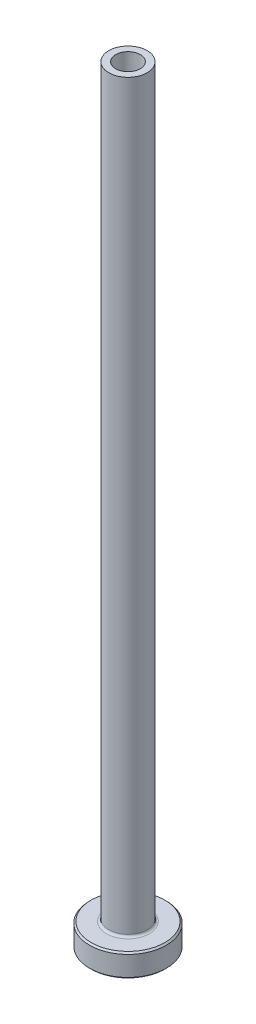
SolidWorks part; units mm, degrees
ref_plane "Front Plane" through (0, 0, 0) normal (0, 0, 1) x (1, 0, 0)
ref_plane "Top Plane" through (0, 0, 0) normal (0, 1, 0) x (1, 0, 0)
ref_plane "Right Plane" through (0, 0, 0) normal (1, 0, 0) x (0, 0, -1)
sketch "Sketch1" plane through (0, 0, 0) normal (0, 0, 1) x (1, 0, 0)
  line L0 (-1.6, 100) -> (-2.5, 100)
  line L1 (-2.5, 100) -> (-2.5, 3)
  line L2 (-2.5, 3) -> (-5, 3)
  line L3 (-5, 3) -> (-5, 0)
  line L4 (4.4, 0) -> (-4.4, 0) construction
  line L5 (-5, 0) -> (-1.85, 0)
  line L6 (-1.6, 55) -> (-1.6, 100)
  line L7 (0, 92.1877) -> (0, -15.5353) construction
  line L8 (0, -4.4) -> (0, 4.4) construction
  line L9 (-1.6, 55) -> (-1.85, 43)
  line L10 (-1.85, 43) -> (-1.85, 0)
  dimension "D1" = 0.25
  dimension "ID" = 3.2
  dimension "OD" = 5
  dimension "L" = 100
  dimension "H" = 10
  dimension "T" = 3
  dimension "N" = 45
  dimension "D2" = 12
revolve "Revolve1" add sketch "Sketch1" angle 360 about L7
fillet "Fillet1" radius 0.3 1 edges at (0, 3, 2.5)
chamfer "Chamfer1" distance 0.2 angle 45 2 edges at (0, 3, 5) (0, 0, 5)
chamfer "Chamfer3" distance 0.5 angle 45 1 edges at (0, 0, 1.85)
